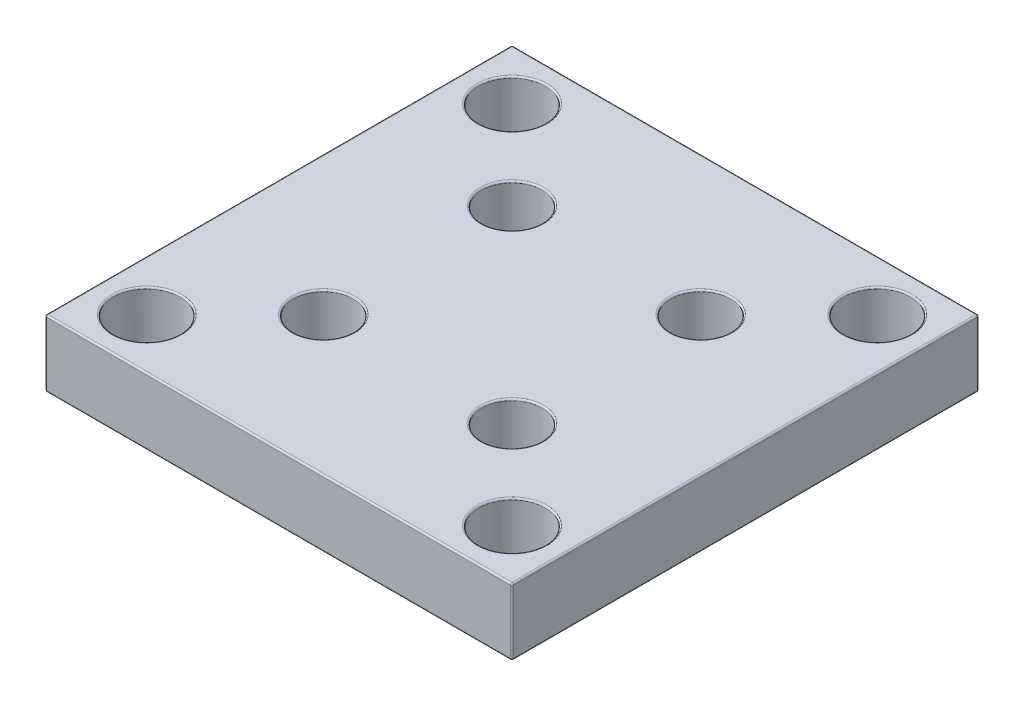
SolidWorks part; units mm, degrees
ref_plane "Front Plane" through (0, 0, 0) normal (0, 0, 1) x (1, 0, 0)
ref_plane "Top Plane" through (0, 0, 0) normal (0, 1, 0) x (1, 0, 0)
ref_plane "Right Plane" through (0, 0, 0) normal (1, 0, 0) x (0, 0, -1)
sketch "Sketch1" plane through (0, 0, 0) normal (0, 1, 0) x (1, 0, 0)
  line L1 (0, 0) -> (140, 0)
  line L2 (0, 0) -> (0, 140)
  line L3 (0, 140) -> (140, 140)
  line L4 (140, 0) -> (140, 140)
  dimension "D1" = 140
  dimension "D2" = 140
extrude "Boss-Extrude1" add sketch "Sketch1" along normal blind 20
sketch "Sketch2" plane through (0, 20, 0) normal (0, 1, 0) x (-1, 0, 0)
  line L0 (-70, -140) -> (-70, 0) construction
  line L1 (-140, -140) -> (0, -140) construction
  line L2 (0, 0) -> (-140, 0) construction
  line L3 (0, -140) -> (-70, -70) construction
  line L4 (-140, 0) -> (-140, -140) construction
  line L5 (-140, -70) -> (0, -70) construction
  line L6 (0, -140) -> (0, 0) construction
  circle A0 centre (-41.7157, -98.2843) radius 5.5
  circle A1 centre (-15.25, -124.75) radius 6.75
  circle A2 centre (-98.2843, -98.2843) radius 5.5
  circle A3 centre (-124.75, -124.75) radius 6.75
  circle A4 centre (-124.75, -15.25) radius 6.75
  circle A5 centre (-98.2843, -41.7157) radius 5.5
  circle A6 centre (-41.7157, -41.7157) radius 5.5
  circle A7 centre (-15.25, -15.25) radius 6.75
  dimension "D2" = 11
  dimension "D3" = 13.5
  dimension "D1" = 45
  dimension "D4" = 40
  dimension "D5" = 54.75
  dimension "D6" = 109.5
extrude "Cut-Extrude1" cut sketch "Sketch2" against normal through all
sketch "Sketch3" plane through (0, 20, 0) normal (0, 1, 0) x (-1, 0, 0)
  circle A0 centre (-15.25, -124.75) radius 10
  circle A1 centre (-15.25, -15.25) radius 10
  circle A2 centre (-124.75, -15.25) radius 10
  circle A3 centre (-124.75, -124.75) radius 10
  circle A4 centre (-41.7157, -98.2843) radius 9
  circle A5 centre (-98.2843, -98.2843) radius 9
  circle A6 centre (-98.2843, -41.7157) radius 9
  circle A7 centre (-41.7157, -41.7157) radius 9
  dimension "D1" = 20
  dimension "D2" = 20
  dimension "D3" = 20
  dimension "D4" = 20
  dimension "D5" = 18
  dimension "D6" = 18
  dimension "D7" = 18
  dimension "D8" = 18
extrude "Cut-Extrude2" cut sketch "Sketch3" against normal blind 15
fillet "Fillet1" radius 0.5 28 edges at (98.2843, 0, -103.7843) (41.7157, 0, -92.7843) (15.25, 0, -118) (124.75, 0, -131.5) (124.75, 0, -8.5) (98.2843, 0, -36.2157) (41.7157, 0, -47.2157) (15.25, 0, -22) (0, 0, -70) (0, 10, -140) (70, 0, -140) (140, 10, -140) (140, 0, -70) (0, 10, 0) (140, 10, 0) (70, 0, 0) (70, 20, -140) (140, 20, -70) (70, 20, 0) (0, 20, -70) (15.25, 20, -114.75) (15.25, 20, -5.25) (124.75, 20, -5.25) (124.75, 20, -114.75) (41.7157, 20, -89.2843) (98.2843, 20, -89.2843) (98.2843, 20, -32.7157) (41.7157, 20, -32.7157)
